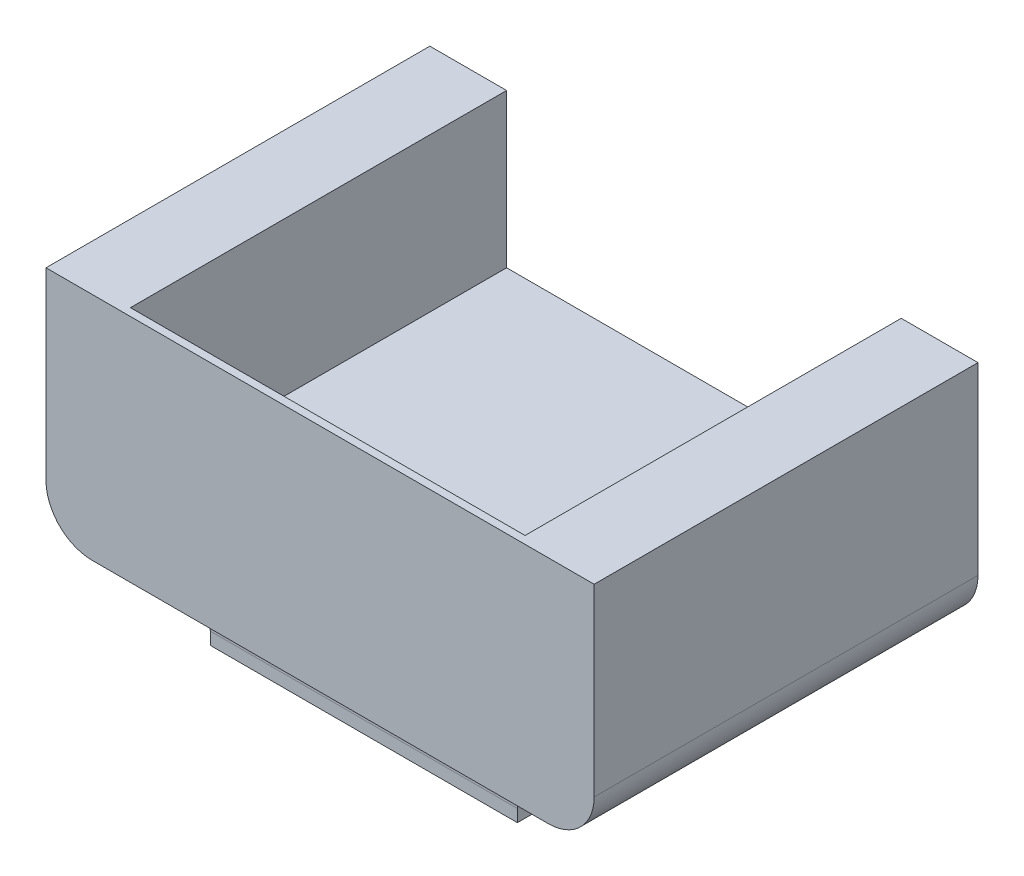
SolidWorks part; units mm, degrees
ref_plane "Plan de face" through (0, 0, 0) normal (0, 0, 1) x (1, 0, 0)
ref_plane "Plan de dessus" through (0, 0, 0) normal (0, 1, 0) x (1, 0, 0)
ref_plane "Plan de droite" through (0, 0, 0) normal (1, 0, 0) x (0, 0, -1)
sketch "Esquisse2" plane through (0, 0, 0) normal (0, 0, 1) x (1, 0, 0)
  line L0 (10.75, 67.3776) -> (-10.75, 67.3776) construction
  line L1 (12.85, 67.3776) -> (-12.85, 67.3776)
  line L7 (-12.85, 67.3776) -> (-12.85, 87.3776)
  line L8 (-12.85, 67.3776) -> (-12.85, 77.3776)
  line L11 (12.85, 67.3776) -> (12.85, 87.3776)
  line L12 (12.85, 67.3776) -> (12.85, 77.3776)
  line L14 (-17.85, 62.3776) -> (-17.85, 77.3776)
  line L15 (17.85, 62.3776) -> (-17.85, 62.3776)
  line L16 (17.85, 62.3776) -> (17.85, 77.3776)
  line L17 (12.85, 77.3776) -> (17.85, 77.3776)
  line L18 (-12.85, 77.3776) -> (-17.85, 77.3776)
  dimension "D3" = 10
  dimension "D1" = 0.1
  dimension "D2" = 0.1
  dimension "D4" = 5
extrude "Extrusion1" add sketch "Esquisse2" against normal blind 25
sketch "Esquisse3" plane through (0, 0, 0) normal (1, 0, 0) x (0, 0, -1)
  line L0 (13.71, 59.7776) -> (6.11, 59.7776) construction
  line L1 (13.65, 59.7776) -> (6.17, 59.7776)
  line L7 (6.17, 59.7776) -> (6.17, 61.8776)
  line L8 (6.17, 59.7776) -> (6.17, 62.3776)
  line L10 (13.65, 61.8776) -> (13.65, 59.7776)
  line L11 (13.65, 62.3776) -> (13.65, 59.7776)
  line L13 (4.85, 61.8776) -> (4.85, 58.5776)
  line L14 (4.85, 62.3776) -> (4.85, 58.5776)
  line L15 (25, 62.3776) -> (0, 62.3776) construction
  line L16 (14.97, 58.5776) -> (14.97, 61.8776)
  line L17 (14.97, 58.5776) -> (14.97, 62.3776)
  line L18 (16.97, 62.3776) -> (14.97, 62.3776)
  line L19 (4.85, 58.5776) -> (2.85, 58.5776)
  line L20 (14.97, 58.5776) -> (16.97, 58.5776)
  line L21 (2.85, 58.5776) -> (2.85, 62.3776)
  line L22 (16.97, 58.5776) -> (16.97, 62.3776)
  line L23 (4.85, 62.3776) -> (2.85, 62.3776)
  line L24 (13.65, 62.3776) -> (6.17, 62.3776)
  dimension "D5" = 2
  dimension "D6" = 2
  dimension "D1" = 0.06
  dimension "D2" = 0.06
  dimension "D3" = 0.06
  dimension "D4" = 0.06
extrude "Extrusion2" add sketch "Esquisse3" along normal mid plane 20
fillet "Congé1" radius 3 4 edges at (0, 62.3776, -16.97) (0, 62.3776, -2.85) (17.85, 62.3776, -12.5) (-17.85, 62.3776, -12.5)
sketch "Esquisse4" plane through (0, 0, 0) normal (0, 0, 1) x (1, 0, 0)
  line L0 (12.85, 77.3776) -> (12.85, 67.3776) construction
  line L1 (12.85, 77.3776) -> (12.85, 67.3776)
  line L2 (-12.85, 67.3776) -> (-12.85, 77.3776) construction
  line L3 (-12.85, 67.3776) -> (-12.85, 77.3776)
  line L4 (12.85, 67.3776) -> (-12.85, 67.3776) construction
  line L5 (12.85, 67.3776) -> (-12.85, 67.3776)
  line L6 (12.85, 77.3776) -> (-12.85, 77.3776)
extrude "Extrusion3" add sketch "Esquisse4" against normal blind 0.5
